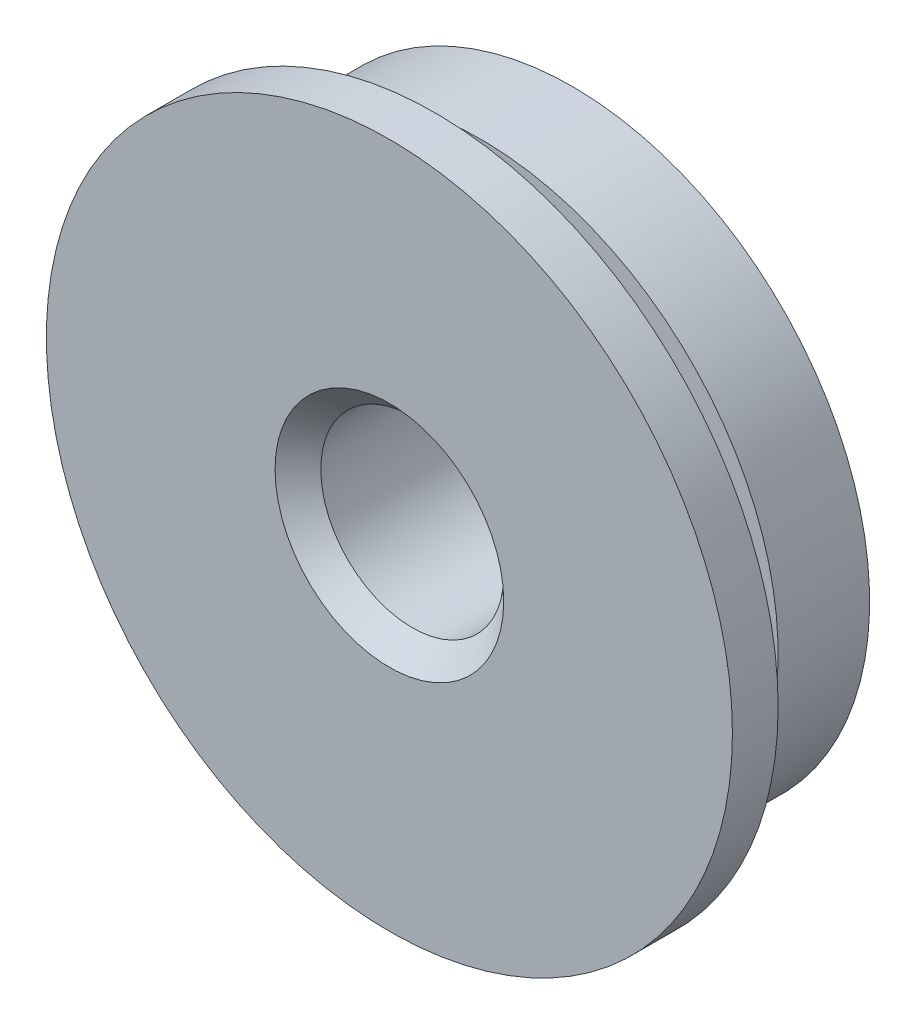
SolidWorks part; units mm, degrees
ref_plane "Front Plane" through (0, 0, 0) normal (0, 0, 1) x (1, 0, 0)
ref_plane "Top Plane" through (0, 0, 0) normal (0, 1, 0) x (1, 0, 0)
ref_plane "Right Plane" through (0, 0, 0) normal (1, 0, 0) x (0, 0, -1)
sketch "Sketch1" plane through (0, 0, 0) normal (0, 0, 1) x (1, 0, 0)
  circle A0 centre (0, 0) radius 15
extrude "Boss-Extrude1" add sketch "Sketch1" against normal blind 2
sketch "Sketch2" plane through (0, 0, -2) normal (0, 0, -1) x (-1, 0, 0)
  circle A0 centre (0, 0) radius 12
extrude "Boss-Extrude2" add sketch "Sketch2" along normal blind 2
sketch "Sketch3" plane through (0, 0, 0) normal (0, 0, 1) x (1, 0, 0)
  circle A0 centre (0, 0) radius 4
sketch "Sketch5" plane through (0, 0, -4) normal (0, 0, -1) x (-1, 0, 0)
  circle A0 centre (0, 0) radius 13
extrude "Boss-Extrude4" add sketch "Sketch5" along normal blind 4
extrude "Cut-Extrude1" cut sketch "Sketch3" against normal blind 10
chamfer "Chamfer1" distance 1 angle 45 2 edges at (4, 0, 0) (-4, 0, -8)
